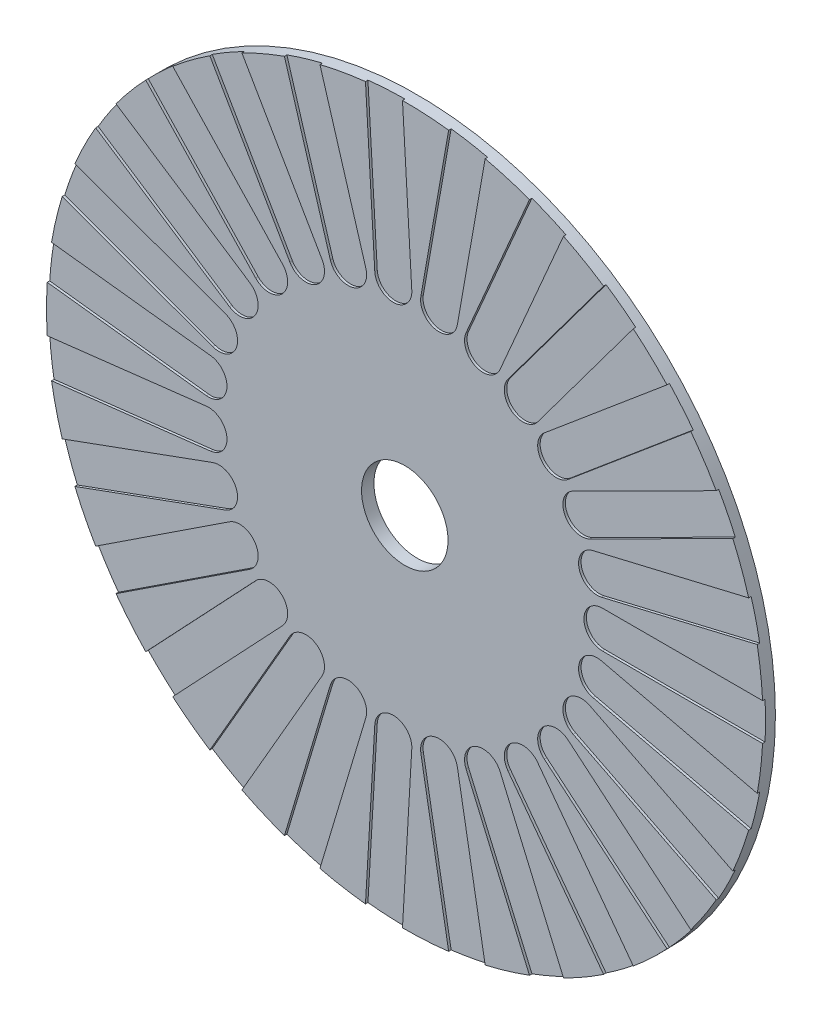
SolidWorks part; units mm, degrees
ref_plane "Plan de face" through (0, 0, 0) normal (0, 0, 1) x (1, 0, 0)
ref_plane "Plan de dessus" through (0, 0, 0) normal (0, 1, 0) x (1, 0, 0)
ref_plane "Plan de droite" through (0, 0, 0) normal (1, 0, 0) x (0, 0, -1)
sketch "Esquisse1" plane through (0, 0, 0) normal (0, 0, 1) x (1, 0, 0)
  circle A0 centre (0, 0) radius 29
  dimension "D1" = 58
extrude "Boss.-Extru.1" add sketch "Esquisse1" along normal blind 1
sketch "Esquisse2" plane through (0, 0, 1) normal (0, 0, 1) x (1, 0, 0)
  line L0 (0, 0) -> (40.4395, 0) construction
  line L1 (16, 1.5) -> (29, 1.5)
  line L2 (16, -1.5) -> (29, -1.5)
  line L3 (15.9146, -2.2303) -> (28.5642, -5.2283)
  line L4 (15.2228, -5.1494) -> (27.8724, -8.1474)
  line L5 (14.9713, -5.8403) -> (26.5885, -11.6747)
  line L6 (13.6249, -8.5212) -> (25.2421, -14.3556)
  line L7 (13.2209, -9.1355) -> (23.1795, -17.4918)
  line L8 (11.2925, -11.4337) -> (21.2511, -19.7899)
  line L9 (10.7577, -11.9382) -> (18.5208, -22.3658)
  line L10 (8.3514, -13.7297) -> (16.1144, -24.1573)
  line L11 (7.7146, -14.0973) -> (12.8636, -26.0341)
  line L12 (4.96, -15.2856) -> (10.109, -27.2224)
  line L13 (4.2556, -15.4965) -> (6.513, -28.299)
  line L14 (1.3012, -16.0174) -> (3.5586, -28.8199)
  line L15 (0.5671, -16.0601) -> (-0.1887, -29.0382)
  line L16 (-2.4278, -15.8857) -> (-3.1837, -28.8637)
  line L17 (-3.1519, -15.758) -> (-6.8803, -28.2119)
  line L18 (-6.0258, -14.8976) -> (-9.7543, -27.3515)
  line L19 (-6.701, -14.6064) -> (-13.201, -25.8647)
  line L20 (-9.299, -13.1064) -> (-15.799, -24.3647)
  line L21 (-9.8888, -12.6673) -> (-18.8099, -22.1232)
  line L22 (-12.0709, -10.6086) -> (-20.9921, -20.0645)
  line L23 (-12.5435, -10.0454) -> (-23.4049, -17.189)
  line L24 (-14.1921, -7.5389) -> (-25.0534, -14.6825)
  line L25 (-14.5221, -6.8819) -> (-26.7381, -11.3281)
  line L26 (-15.5481, -4.0628) -> (-27.7641, -8.509)
  line L27 (-15.7177, -3.3473) -> (-28.6298, -4.8566)
  line L28 (-16.066, -0.3676) -> (-28.9781, -1.8768)
  line L29 (-16.066, 0.3676) -> (-28.9781, 1.8768)
  line L30 (-15.7177, 3.3473) -> (-28.6298, 4.8566)
  line L31 (-15.5481, 4.0628) -> (-27.7641, 8.509)
  line L32 (-14.5221, 6.8819) -> (-26.7381, 11.3281)
  line L33 (-14.1921, 7.5389) -> (-25.0534, 14.6825)
  line L34 (-12.5435, 10.0454) -> (-23.4049, 17.189)
  line L35 (-12.0709, 10.6086) -> (-20.9921, 20.0645)
  line L36 (-9.8888, 12.6673) -> (-18.8099, 22.1232)
  line L37 (-9.299, 13.1064) -> (-15.799, 24.3647)
  line L38 (-6.701, 14.6064) -> (-13.201, 25.8647)
  line L39 (-6.0258, 14.8976) -> (-9.7543, 27.3515)
  line L40 (-3.1519, 15.758) -> (-6.8803, 28.2119)
  line L41 (-2.4278, 15.8857) -> (-3.1837, 28.8637)
  line L42 (0.5671, 16.0601) -> (-0.1887, 29.0382)
  line L43 (1.3012, 16.0174) -> (3.5586, 28.8199)
  line L44 (4.2556, 15.4965) -> (6.513, 28.299)
  line L45 (4.96, 15.2856) -> (10.109, 27.2224)
  line L46 (7.7146, 14.0973) -> (12.8636, 26.0341)
  line L47 (8.3514, 13.7297) -> (16.1144, 24.1573)
  line L48 (10.7577, 11.9382) -> (18.5208, 22.3658)
  line L49 (11.2925, 11.4337) -> (21.2511, 19.7899)
  line L50 (13.2209, 9.1355) -> (23.1795, 17.4918)
  line L51 (13.6249, 8.5212) -> (25.2421, 14.3556)
  line L52 (14.9713, 5.8403) -> (26.5885, 11.6747)
  line L53 (15.2228, 5.1494) -> (27.8724, 8.1474)
  line L54 (15.9146, 2.2303) -> (28.5642, 5.2283)
  arc A0 (15.9146, -2.2303) -> (15.2228, -5.1494) centre (15.5687, -3.6899) ccw
  arc A1 (16, 1.5) -> (16, -1.5) centre (16, 0) ccw
  arc A2 (29, -1.5) -> (29, 1.5) centre (29, 0) ccw
  arc A3 (27.8724, -8.1474) -> (28.5642, -5.2283) centre (28.2183, -6.6879) ccw
  arc A4 (14.9713, -5.8403) -> (13.6249, -8.5212) centre (14.2981, -7.1808) ccw
  arc A5 (25.2421, -14.3556) -> (26.5885, -11.6747) centre (25.9153, -13.0152) ccw
  arc A6 (13.2209, -9.1355) -> (11.2925, -11.4337) centre (12.2567, -10.2846) ccw
  arc A7 (21.2511, -19.7899) -> (23.1795, -17.4918) centre (22.2153, -18.6408) ccw
  arc A8 (10.7577, -11.9382) -> (8.3514, -13.7297) centre (9.5545, -12.834) ccw
  arc A9 (16.1144, -24.1573) -> (18.5208, -22.3658) centre (17.3176, -23.2616) ccw
  arc A10 (7.7146, -14.0973) -> (4.96, -15.2856) centre (6.3373, -14.6915) ccw
  arc A11 (10.109, -27.2224) -> (12.8636, -26.0341) centre (11.4863, -26.6283) ccw
  arc A12 (4.2556, -15.4965) -> (1.3012, -16.0174) centre (2.7784, -15.7569) ccw
  arc A13 (3.5586, -28.8199) -> (6.513, -28.299) centre (5.0358, -28.5594) ccw
  arc A14 (0.5671, -16.0601) -> (-2.4278, -15.8857) centre (-0.9303, -15.9729) ccw
  arc A15 (-3.1837, -28.8637) -> (-0.1887, -29.0382) centre (-1.6862, -28.9509) ccw
  arc A16 (-3.1519, -15.758) -> (-6.0258, -14.8976) centre (-4.5889, -15.3278) ccw
  arc A17 (-9.7543, -27.3515) -> (-6.8803, -28.2119) centre (-8.3173, -27.7817) ccw
  arc A18 (-6.701, -14.6064) -> (-9.299, -13.1064) centre (-8, -13.8564) ccw
  arc A19 (-15.799, -24.3647) -> (-13.201, -25.8647) centre (-14.5, -25.1147) ccw
  arc A20 (-9.8888, -12.6673) -> (-12.0709, -10.6086) centre (-10.9799, -11.638) ccw
  arc A21 (-20.9921, -20.0645) -> (-18.8099, -22.1232) centre (-19.901, -21.0938) ccw
  arc A22 (-12.5435, -10.0454) -> (-14.1921, -7.5389) centre (-13.3678, -8.7921) ccw
  arc A23 (-25.0534, -14.6825) -> (-23.4049, -17.189) centre (-24.2291, -15.9358) ccw
  arc A24 (-14.5221, -6.8819) -> (-15.5481, -4.0628) centre (-15.0351, -5.4723) ccw
  arc A25 (-27.7641, -8.509) -> (-26.7381, -11.3281) centre (-27.2511, -9.9186) ccw
  arc A26 (-15.7177, -3.3473) -> (-16.066, -0.3676) centre (-15.8918, -1.8575) ccw
  arc A27 (-28.9781, -1.8768) -> (-28.6298, -4.8566) centre (-28.8039, -3.3667) ccw
  arc A28 (-16.066, 0.3676) -> (-15.7177, 3.3473) centre (-15.8918, 1.8575) ccw
  arc A29 (-28.6298, 4.8566) -> (-28.9781, 1.8768) centre (-28.8039, 3.3667) ccw
  arc A30 (-15.5481, 4.0628) -> (-14.5221, 6.8819) centre (-15.0351, 5.4723) ccw
  arc A31 (-26.7381, 11.3281) -> (-27.7641, 8.509) centre (-27.2511, 9.9186) ccw
  arc A32 (-14.1921, 7.5389) -> (-12.5435, 10.0454) centre (-13.3678, 8.7921) ccw
  arc A33 (-23.4049, 17.189) -> (-25.0534, 14.6825) centre (-24.2291, 15.9358) ccw
  arc A34 (-12.0709, 10.6086) -> (-9.8888, 12.6673) centre (-10.9799, 11.638) ccw
  arc A35 (-18.8099, 22.1232) -> (-20.9921, 20.0645) centre (-19.901, 21.0938) ccw
  arc A36 (-9.299, 13.1064) -> (-6.701, 14.6064) centre (-8, 13.8564) ccw
  arc A37 (-13.201, 25.8647) -> (-15.799, 24.3647) centre (-14.5, 25.1147) ccw
  arc A38 (-6.0258, 14.8976) -> (-3.1519, 15.758) centre (-4.5889, 15.3278) ccw
  arc A39 (-6.8803, 28.2119) -> (-9.7543, 27.3515) centre (-8.3173, 27.7817) ccw
  arc A40 (-2.4278, 15.8857) -> (0.5671, 16.0601) centre (-0.9303, 15.9729) ccw
  arc A41 (-0.1887, 29.0382) -> (-3.1837, 28.8637) centre (-1.6862, 28.9509) ccw
  arc A42 (1.3012, 16.0174) -> (4.2556, 15.4965) centre (2.7784, 15.7569) ccw
  arc A43 (6.513, 28.299) -> (3.5586, 28.8199) centre (5.0358, 28.5594) ccw
  arc A44 (4.96, 15.2856) -> (7.7146, 14.0973) centre (6.3373, 14.6915) ccw
  arc A45 (12.8636, 26.0341) -> (10.109, 27.2224) centre (11.4863, 26.6283) ccw
  arc A46 (8.3514, 13.7297) -> (10.7577, 11.9382) centre (9.5545, 12.834) ccw
  arc A47 (18.5208, 22.3658) -> (16.1144, 24.1573) centre (17.3176, 23.2616) ccw
  arc A48 (11.2925, 11.4337) -> (13.2209, 9.1355) centre (12.2567, 10.2846) ccw
  arc A49 (23.1795, 17.4918) -> (21.2511, 19.7899) centre (22.2153, 18.6408) ccw
  arc A50 (13.6249, 8.5212) -> (14.9713, 5.8403) centre (14.2981, 7.1808) ccw
  arc A51 (26.5885, 11.6747) -> (25.2421, 14.3556) centre (25.9153, 13.0152) ccw
  arc A52 (15.2228, 5.1494) -> (15.9146, 2.2303) centre (15.5687, 3.6899) ccw
  arc A53 (28.5642, 5.2283) -> (27.8724, 8.1474) centre (28.2183, 6.6879) ccw
  point P167 (0, 0)
  dimension "D4" = 3
  dimension "D5" = 3
  dimension "D2" = 16
  dimension "D3" = 29
  dimension "D6" = 27
extrude "Enlèv. mat.-Extru.1" cut sketch "Esquisse2" against normal blind 0.2
sketch "Esquisse3" plane through (0, 0, 1) normal (0, 0, 1) x (1, 0, 0)
  circle A0 centre (0, 0) radius 3.5
  dimension "D1" = 7
extrude "Enlèv. mat.-Extru.2" cut sketch "Esquisse3" against normal through all
